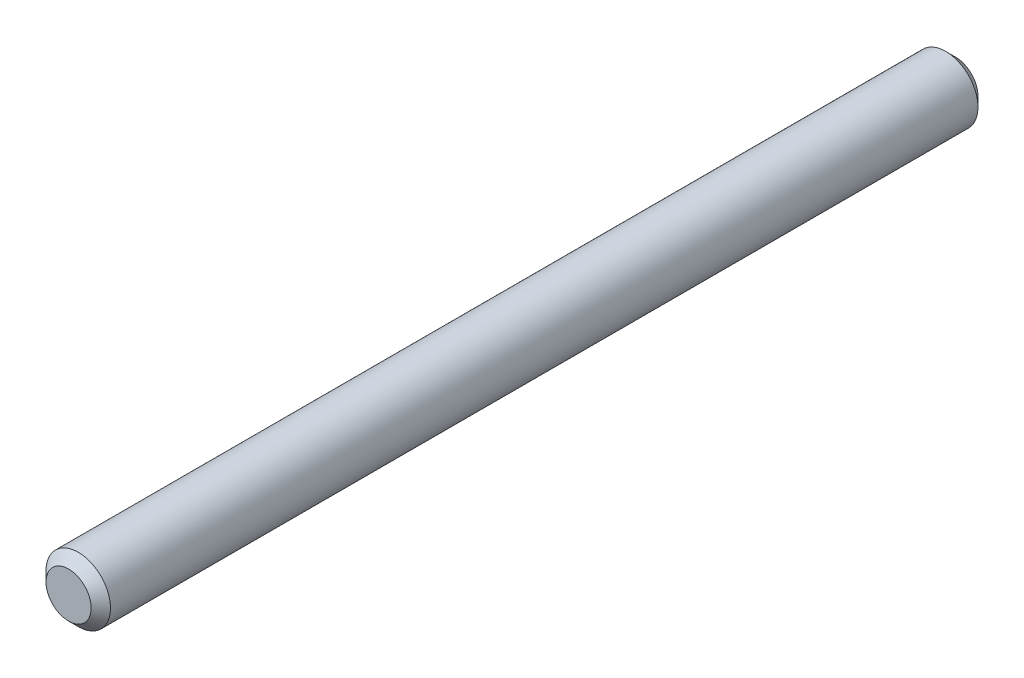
SolidWorks part; units mm, degrees
ref_plane "Front Plane" through (0, 0, 0) normal (0, 0, 1) x (1, 0, 0)
ref_plane "Top Plane" through (0, 0, 0) normal (0, 1, 0) x (1, 0, 0)
ref_plane "Right Plane" through (0, 0, 0) normal (1, 0, 0) x (0, 0, -1)
ref_plane "Plane1" through (0, 0, 0) normal (0, -1, 0) x (1, 0, 0)
sketch "Sketch1" plane through (0, 0, 0) normal (0, -1, 0) x (1, 0, 0)
  line L0 (0.7, 13.75) -> (0, 13.75)
  line L1 (0, 13.75) -> (0, -13.75)
  line L2 (0, -13.75) -> (0.7, -13.75)
  line L3 (0.7, -13.75) -> (1, -13.45)
  line L4 (1, -13.45) -> (1, 13.45)
  line L5 (1, 13.45) -> (0.7, 13.75)
  line L6 (0, 13.75) -> (0, -13.75) construction
revolve "Revolve1" add sketch "Sketch1" angle 360 about L6
